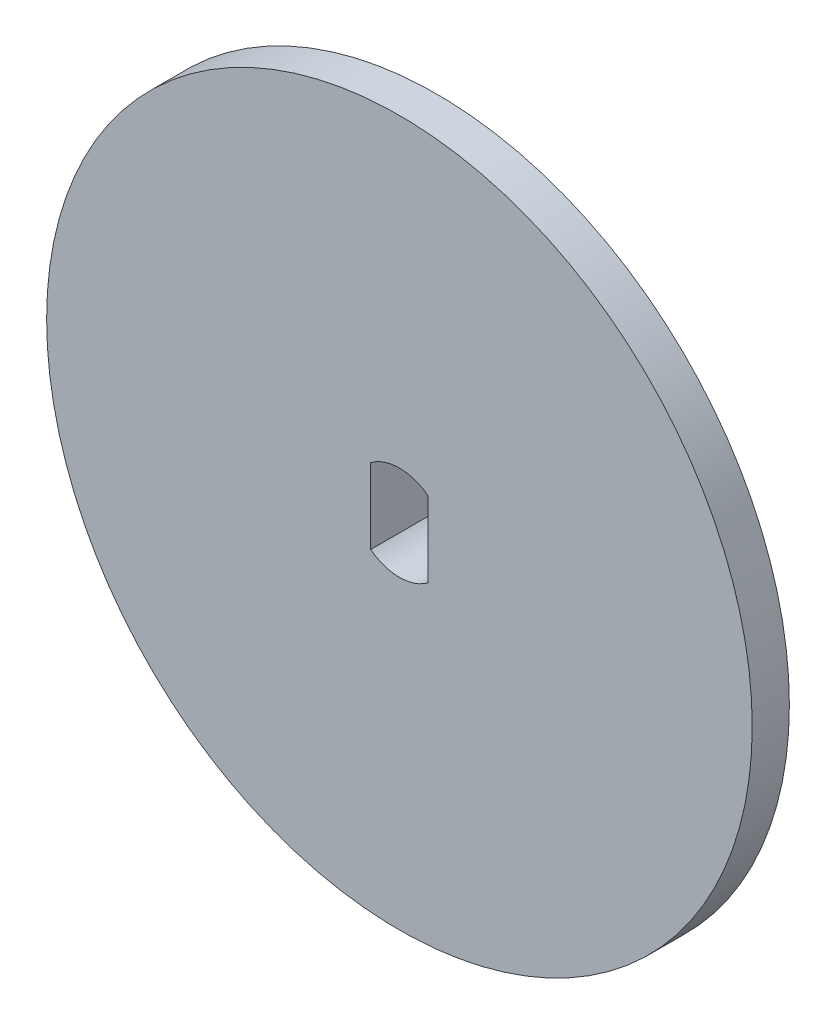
SolidWorks part; units mm, degrees
ref_plane "Plan de face" through (0, 0, 0) normal (0, 0, 1) x (1, 0, 0)
ref_plane "Plan de dessus" through (0, 0, 0) normal (0, 1, 0) x (1, 0, 0)
ref_plane "Plan de droite" through (0, 0, 0) normal (1, 0, 0) x (0, 0, -1)
sketch "Esquisse1" plane through (0, 0, 0) normal (0, 0, 1) x (1, 0, 0)
  circle A0 centre (0, 0) radius 17.5
  dimension "D1" = 35
extrude "Boss.-Extru.1" add sketch "Esquisse1" along normal blind 40
sketch "Esquisse2" plane through (0, 0, 40) normal (0, 0, 1) x (1, 0, 0)
  circle A0 centre (0, 0) radius 19
  dimension "D1" = 38
extrude "Boss.-Extru.2" add sketch "Esquisse2" against normal blind 2
sketch "Esquisse3" plane through (0, 0, 0) normal (0, 0, -1) x (-1, 0, 0)
  circle A0 centre (0, 0) radius 19
  dimension "D1" = 38
extrude "Boss.-Extru.3" add sketch "Esquisse3" against normal blind 2
sketch "Esquisse4" plane through (0, 0, 0) normal (0, 0, -1) x (-1, 0, 0)
  line L2 (-1.55, 2.0248) -> (-1.55, -2.0248)
  line L4 (1.55, 2.0248) -> (1.55, -2.0248)
  line L5 (-1.6, 3.0036) -> (1.5569, -2.9227) construction
  line L6 (-1.5, -3.0036) -> (1.5, 3.0036) construction
  arc A0 (1.55, 2.0248) -> (-1.55, 2.0248) centre (0, 0) ccw
  arc A1 (-1.55, -2.0248) -> (1.55, -2.0248) centre (0, 0) ccw
  dimension "D1" = 5.1
  dimension "D2" = 1.55
  dimension "D3" = 3.1
extrude "Enlèv. mat.-Extru.1" cut sketch "Esquisse4" against normal blind 5
shell "Coque1" thickness 2.5
sketch "Esquisse5" plane through (0, 0, 7.5) normal (0, 0, 1) x (1, 0, 0)
  line L0 (1.55, 2.0248) -> (1.55, -2.0248) construction
  line L1 (-1.55, -2.0248) -> (-1.55, 2.0248) construction
  line L2 (1.55, 2.0248) -> (1.55, -2.0248)
  line L3 (-1.55, -2.0248) -> (-1.55, 2.0248)
  circle A0 centre (0, 0) radius 5
  arc A1 (-1.55, -2.0248) -> (1.55, -2.0248) centre (0, 0) ccw construction
  arc A2 (1.55, 2.0248) -> (-1.55, 2.0248) centre (0, 0) ccw construction
  arc A3 (-1.55, -2.0248) -> (1.55, -2.0248) centre (0, 0) ccw
  arc A4 (1.55, 2.0248) -> (-1.55, 2.0248) centre (0, 0) ccw
  dimension "D1" = 10
extrude "Boss.-Extru.4" add sketch "Esquisse5" against normal up to surface and the other way up to surface
fillet "Congé1" radius 4 9 edges at (15, 0, 2.5) (0, 5.05, 2.5) (-4.05, -2.9744, 2.5) (0, -5.05, 2.5) (4.05, 2.9744, 2.5) (4.05, -2.9744, 2.5) (-4.05, 2.9744, 2.5) (-5, 0, 2.5) (5, 0, 2.5)
sketch "Esquisse6" plane through (0, 0, 40) normal (0, 0, 1) x (1, 0, 0)
  circle A0 centre (0, 0) radius 3.05
  dimension "D1" = 6.1
extrude "Enlèv. mat.-Extru.3" cut sketch "Esquisse6" against normal blind 30
sketch "Esquisse7" plane through (0, 0, 40) normal (0, 0, 1) x (1, 0, 0)
  line L0 (5, 0) -> (15, 0) construction
  line L2 (15.9108, 1) -> (4.0892, 1)
  line L3 (15.9108, 1) -> (15.9108, -1)
  line L4 (15.9108, -1) -> (4.0892, -1)
  line L5 (4.0892, 1) -> (4.0892, -1)
  line L6 (15.9108, 1) -> (4.0892, -1) construction
  line L7 (15.9108, -1) -> (4.0892, 1) construction
  arc A0 (4.05, -2.9321) -> (4.05, 2.9321) centre (0, 0) ccw construction
  circle A1 centre (0, 0) radius 15 construction
  point P8 (10, 0)
  dimension "D1" = 11.8216
  dimension "D2" = 2
extrude "Boss.-Extru.5" add sketch "Esquisse7" against normal up to next
pattern_circular "Répétition circulaire1" count 5 over 360 about axis through (0, 0, 0) along (0, 0, 1) of "Boss.-Extru.5"
sketch "Esquisse8" plane through (0, 0, 0) normal (0, 0, -1) x (-1, 0, 0)
  line L0 (-1.55, 2.0248) -> (-1.55, -2.0248) construction
  line L1 (1.55, -2.0248) -> (1.55, 2.0248) construction
  line L2 (-1.55, 2.0248) -> (-1.55, -2.0248)
  line L3 (1.55, -2.0248) -> (1.55, 2.0248)
  arc A0 (-1.55, -2.0248) -> (1.55, -2.0248) centre (0, 0) ccw construction
  arc A1 (1.55, 2.0248) -> (-1.55, 2.0248) centre (0, 0) ccw construction
  arc A2 (-1.55, -2.0248) -> (1.55, -2.0248) centre (0, 0) ccw
  arc A3 (1.55, 2.0248) -> (-1.55, 2.0248) centre (0, 0) ccw
  circle A4 centre (0, 0) radius 4.3
  dimension "D1" = 8.6
extrude "Boss.-Extru.6" add sketch "Esquisse8" along normal blind 4
fillet "Congé2" radius 2 1 edges at (4.3, 0, 0)
sketch "Esquisse9" plane through (0, 0, 0) normal (0, 1, 0) x (1, 0, 0)
  line L0 (0, -40) -> (0, -6.5) construction
  line L1 (20.5085, -42.2013) -> (-20.5085, -42.2013)
  line L2 (20.5085, -42.2013) -> (20.5085, -2)
  line L3 (20.5085, -2) -> (-20.5085, -2)
  line L4 (-20.5085, -42.2013) -> (-20.5085, -2)
  line L5 (20.5085, -42.2013) -> (-20.5085, -2) construction
  line L6 (20.5085, -2) -> (-20.5085, -42.2013) construction
  line L7 (19, 0) -> (-19, 0) construction
  point P0 (0, -22.1007)
  dimension "D1" = 2
extrude "Enlèv. mat.-Extru.4" cut sketch "Esquisse9" against normal through all and the other way through all
